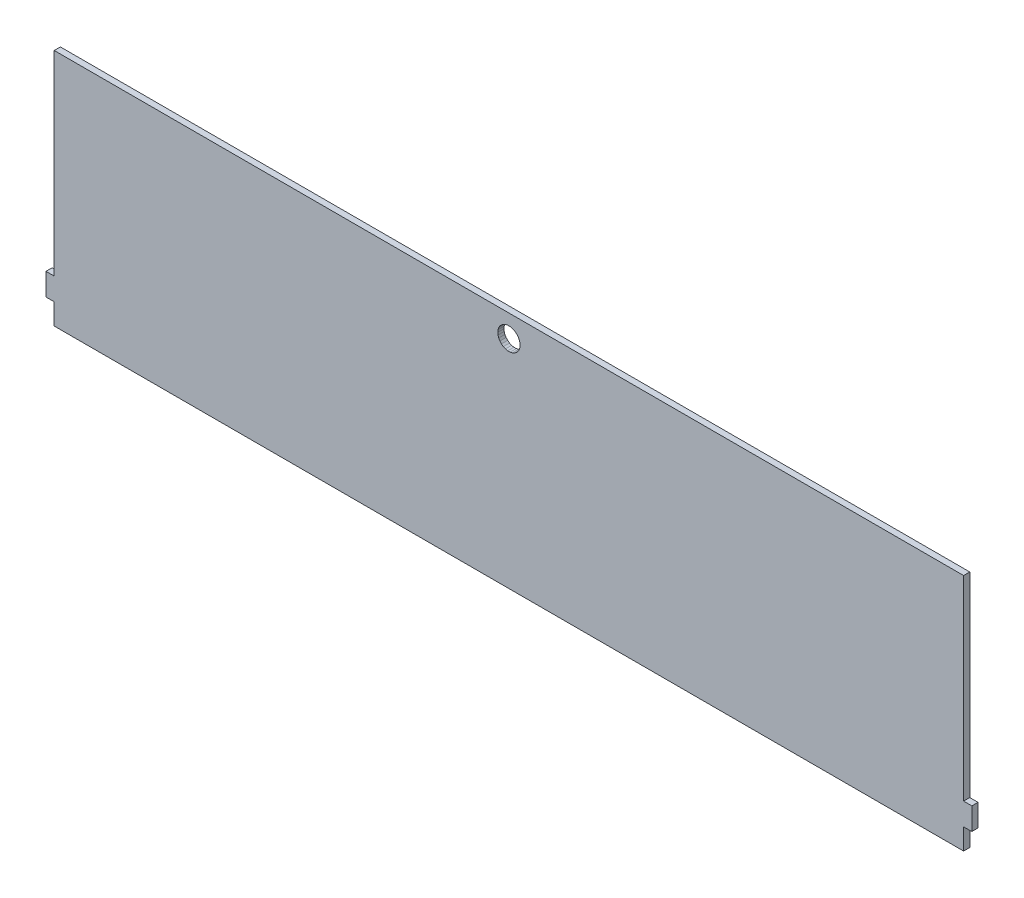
SolidWorks part; units mm, degrees
ref_plane "Спереди" through (0, 0, 0) normal (0, 0, 1) x (1, 0, 0)
ref_plane "Сверху" through (0, 0, 0) normal (0, 1, 0) x (1, 0, 0)
ref_plane "Справа" through (0, 0, 0) normal (1, 0, 0) x (0, 0, -1)
sketch "Sketch4" plane through (0, 0, 0) normal (0, 0, 1) x (1, 0, 0)
  line L0 (1648.8, 652.67) -> (1664.8, 652.67)
  line L1 (1664.8, 652.67) -> (1664.8, 695.942)
  line L2 (1664.8, 695.942) -> (1648.8, 695.942)
  line L3 (1648.8, 695.942) -> (1648.8, 1075.802)
  line L4 (1648.8, 1075.802) -> (-119.2, 1075.802)
  line L5 (-119.2, 1075.802) -> (-119.2, 695.942)
  line L6 (-119.2, 695.942) -> (-135.2, 695.942)
  line L7 (-135.2, 695.942) -> (-135.2, 652.67)
  line L8 (-135.2, 652.67) -> (-119.2, 652.67)
  line L9 (-119.2, 652.67) -> (-119.2, 611.8)
  line L10 (-119.2, 611.8) -> (1648.8, 611.8)
  line L11 (1648.8, 611.8) -> (1648.8, 652.67)
  line L12 (762.54, 1011.009) -> (758.11, 1011.95)
  line L13 (758.11, 1011.95) -> (753.98, 1013.79)
  line L14 (753.98, 1013.79) -> (750.32, 1016.448)
  line L15 (750.32, 1016.448) -> (747.3, 1019.81)
  line L16 (747.3, 1019.81) -> (745.03, 1023.727)
  line L17 (745.03, 1023.727) -> (743.64, 1028.029)
  line L18 (743.64, 1028.029) -> (743.16, 1032.527)
  line L19 (743.16, 1032.527) -> (743.64, 1037.026)
  line L20 (743.64, 1037.026) -> (745.03, 1041.328)
  line L21 (745.03, 1041.328) -> (747.3, 1045.245)
  line L22 (747.3, 1045.245) -> (750.32, 1048.606)
  line L23 (750.32, 1048.606) -> (753.98, 1051.265)
  line L24 (753.98, 1051.265) -> (758.11, 1053.105)
  line L25 (758.11, 1053.105) -> (762.54, 1054.045)
  line L26 (762.54, 1054.045) -> (767.06, 1054.045)
  line L27 (767.06, 1054.045) -> (771.49, 1053.105)
  line L28 (771.49, 1053.105) -> (775.62, 1051.265)
  line L29 (775.62, 1051.265) -> (779.28, 1048.606)
  line L30 (779.28, 1048.606) -> (782.3, 1045.245)
  line L31 (782.3, 1045.245) -> (784.57, 1041.328)
  line L32 (784.57, 1041.328) -> (785.96, 1037.026)
  line L33 (785.96, 1037.026) -> (786.44, 1032.527)
  line L34 (786.44, 1032.527) -> (785.96, 1028.029)
  line L35 (785.96, 1028.029) -> (784.57, 1023.727)
  line L36 (784.57, 1023.727) -> (782.3, 1019.81)
  line L37 (782.3, 1019.81) -> (779.28, 1016.448)
  line L38 (779.28, 1016.448) -> (775.62, 1013.79)
  line L39 (775.62, 1013.79) -> (771.49, 1011.95)
  line L40 (771.49, 1011.95) -> (767.06, 1011.009)
  line L41 (767.06, 1011.009) -> (762.54, 1011.009)
  dimension "D1" = 379.86
  dimension "D2" = 40.87
extrude "Boss-Extrude2" add sketch "Sketch4" along normal blind 12 separate body
sketch "Sketch6" plane through (-135.2, 0, 0) normal (-1, 0, 0) x (0, 0, 1)
  circle A0 centre (6, 674.306) radius 22.4525
